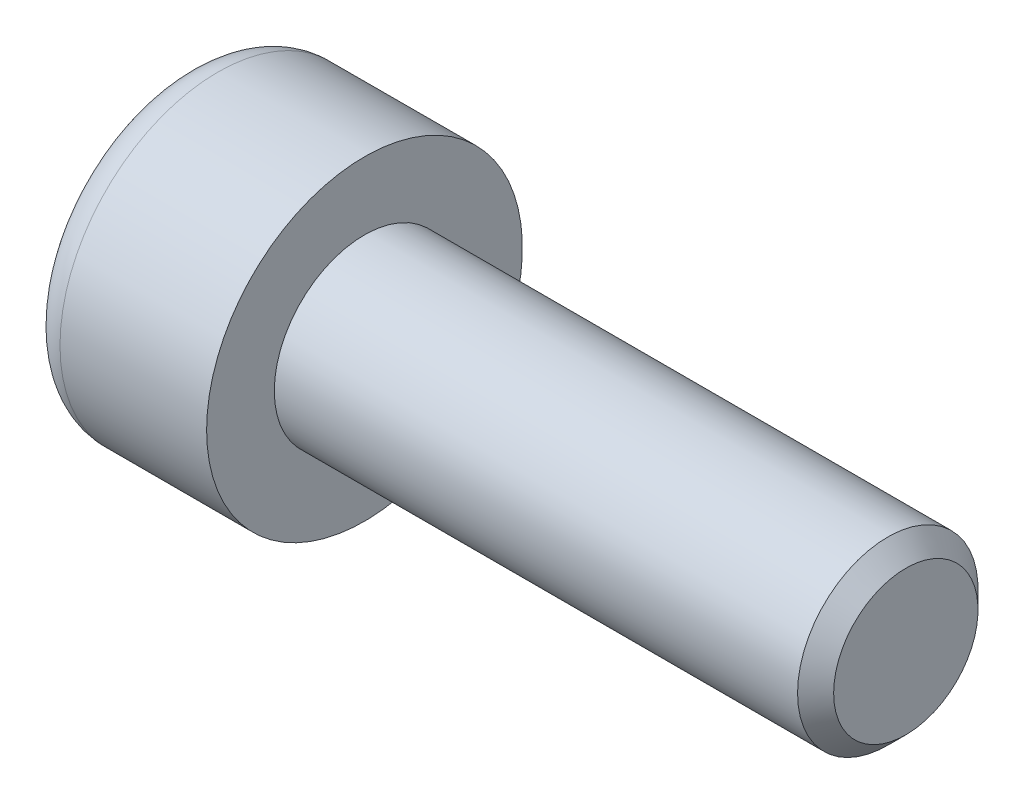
SolidWorks part; units mm, degrees
ref_plane "Face" through (0, 0, 0) normal (0, 0, 1) x (1, 0, 0)
ref_plane "Dessus" through (0, 0, 0) normal (0, 1, 0) x (1, 0, 0)
ref_plane "Droite" through (0, 0, 0) normal (1, 0, 0) x (0, 0, -1)
sketch "Esquisse1" plane through (0, 0, 0) normal (0, 0, 1) x (1, 0, 0)
  line L0 (-28.9827, 0) -> (28.9827, 0) construction
  line L1 (-4, 0) -> (-4, 3.5)
  line L2 (-4, 3.5) -> (0, 3.5)
  line L3 (0, 3.5) -> (0, 2)
  line L4 (0, 2) -> (12, 2)
  line L5 (12, 2) -> (12, 0)
  line L6 (12, 0) -> (-4, 0)
  dimension "D1" = 2
  dimension "D2" = 12
  dimension "D3" = 3.5
  dimension "D4" = 4
revolve "Base-Révolution" add sketch "Esquisse1" angle 360 about L0
chamfer "Chanfrein1" distance 0.4 angle 45 1 edges at (12, 0, 2)
fillet "Congé1" radius 0.75 1 edges at (-4, 0, 3.5)
sketch "Esquisse2" plane through (-4, 0, 0) normal (-1, 0, 0) x (0, 0, 1)
  line L0 (0.866, -1.5) -> (-0.866, -1.5)
  line L1 (-0.866, -1.5) -> (-1.7321, 0)
  line L2 (-1.7321, 0) -> (-0.866, 1.5)
  line L3 (-0.866, 1.5) -> (0.866, 1.5)
  line L4 (0.866, 1.5) -> (1.7321, 0)
  line L5 (1.7321, 0) -> (0.866, -1.5)
  circle A0 centre (0, 0) radius 1.5 construction
  dimension "D1" = 3
  dimension "D2" = 120
  dimension "D3" = 120
  dimension "D4" = 120
  dimension "D5" = 120
extrude "Enlèv. mat.-Extru.1" cut sketch "Esquisse2" against normal blind 2.5
sketch "Esq_WRNL_Compact001" plane through (0, 0, 0) normal (0, 0, 1) x (1, 0, 0)
  line L0 (-5, -4.5) -> (-5, 4.5)
  line L1 (13, -4.5) -> (13, 4.5)
  line L2 (-5, -4.5) -> (13, -4.5)
  line L3 (-5, 4.5) -> (13, 4.5)
